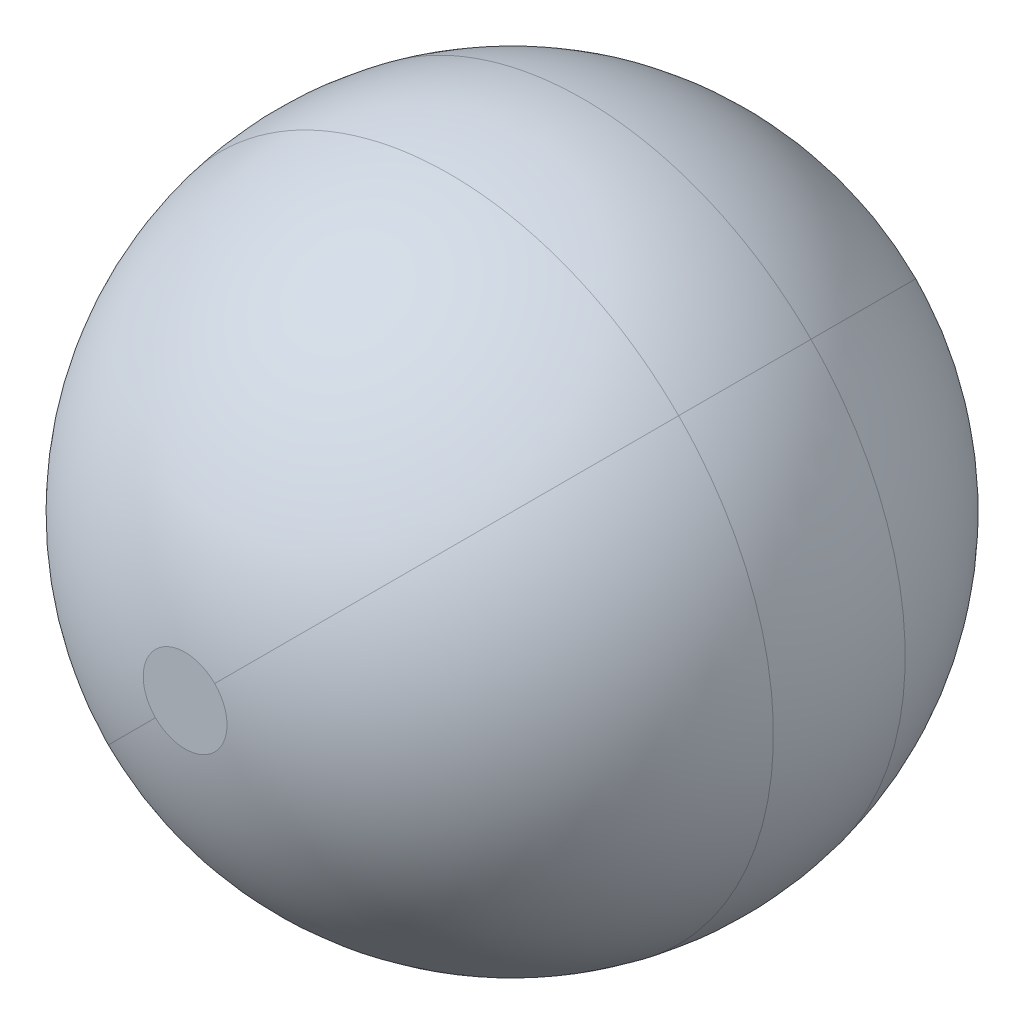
SolidWorks part; units mm, degrees
ref_plane "Vorne" through (0, 0, 0) normal (0, 0, 1) x (1, 0, 0)
ref_plane "Oben" through (0, 0, 0) normal (0, 1, 0) x (1, 0, 0)
ref_plane "Rechts" through (0, 0, 0) normal (1, 0, 0) x (0, 0, -1)
sketch "Skizze2" plane through (0, 0, 0) normal (0, 0, 1) x (1, 0, 0)
  line L0 (0, -2.466) -> (0, 2.466)
  arc A0 (0, 2.466) -> (0, -2.466) centre (0, 0) ccw
  dimension "D1" = 4.932
revolve "Rotation1" add sketch "Skizze2" angle 360 about L0
ref_plane "Ebene1" through (0, 0, 2.466) normal (0, 0, 1) x (1, 0, 0)
sketch "Skizze3" plane through (0, 0, 2.466) normal (0, 0, 1) x (1, 0, 0)
  circle A0 centre (0, 0) radius 2.466
  dimension "D1" = 4.932
extrude "Schnitt-Linear austragen1" [suppressed] cut sketch "Skizze3" against normal blind 0.05
mirror "Spiegeln1" [suppressed] about plane through (0, 0, 0) normal (0, 0, 1)
ref_plane "Ebene2" through (0, 0, 0) normal (0.7071, -0.7071, 0) x (-0.7071, -0.7071, 0)
sketch "Skizze4" plane through (0, 0, 0) normal (0.7071, -0.7071, 0) x (-0.7071, -0.7071, 0)
  circle A0 centre (0, 0) radius 2.466
ref_plane "Ebene3" through (0, 0, 2.466) normal (0, 0, 1) x (1, 0, 0)
sketch "Skizze6" plane through (0, 0, 2.466) normal (0, 0, 1) x (1, 0, 0)
  circle A0 centre (0, 0) radius 2.466
extrude "Schnitt-Linear austragen2" cut sketch "Skizze6" against normal blind 0.01
mirror "Spiegeln2" about plane through (0, 0, 0) normal (0, 0, 1) of "Schnitt-Linear austragen2"
ref_plane "Ebene4" through (0, 0, -0.534) normal (0, 0, 1) x (1, 0, 0)
ref_plane "Ebene5" through (0, 0, 0.466) normal (0, 0, 1) x (1, 0, 0)
